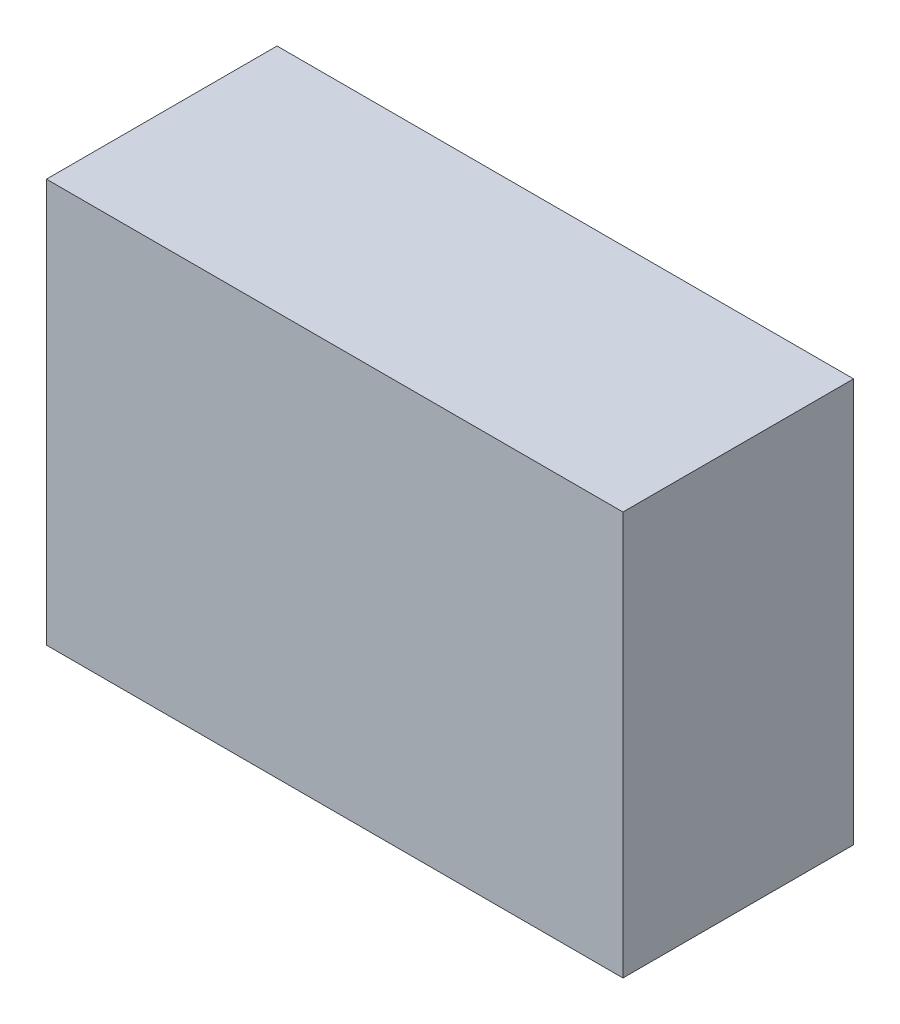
SolidWorks part; units mm, degrees
ref_plane "Płaszczyzna przednia" through (0, 0, 0) normal (0, 0, 1) x (1, 0, 0)
ref_plane "Płaszczyzna górna" through (0, 0, 0) normal (0, 1, 0) x (1, 0, 0)
ref_plane "Płaszczyzna prawa" through (0, 0, 0) normal (1, 0, 0) x (0, 0, -1)
sketch "Szkic1" plane through (0, 0, 0) normal (0, 0, 1) x (1, 0, 0)
  line L1 (50, -35) -> (-50, -35)
  line L2 (50, -35) -> (50, 35)
  line L3 (50, 35) -> (-50, 35)
  line L4 (-50, -35) -> (-50, 35)
  line L5 (50, -35) -> (-50, 35) construction
  line L6 (50, 35) -> (-50, -35) construction
  point P0 (0, 0)
  dimension "D1" = 70
  dimension "D2" = 100
extrude "Dodanie-wyciągnięcie1" add sketch "Szkic1" along normal blind 40
sketch "Szkic2" plane through (0, -35, 0) normal (0, -1, 0) x (1, 0, 0)
  line L0 (-25, 20) -> (25, 20) construction
  line L1 (0, 40) -> (0, 20) construction
  line L2 (-50, 40) -> (50, 40) construction
  line L3 (0, 20) -> (0, 0) construction
  line L4 (-50, 0) -> (50, 0) construction
  circle A0 centre (-25, 20) radius 9
  circle A1 centre (25, 20) radius 9
  dimension "D2" = 18
  dimension "D1" = 50
extrude "Wytnij-wyciągnięcie1" cut sketch "Szkic2" against normal blind 35
